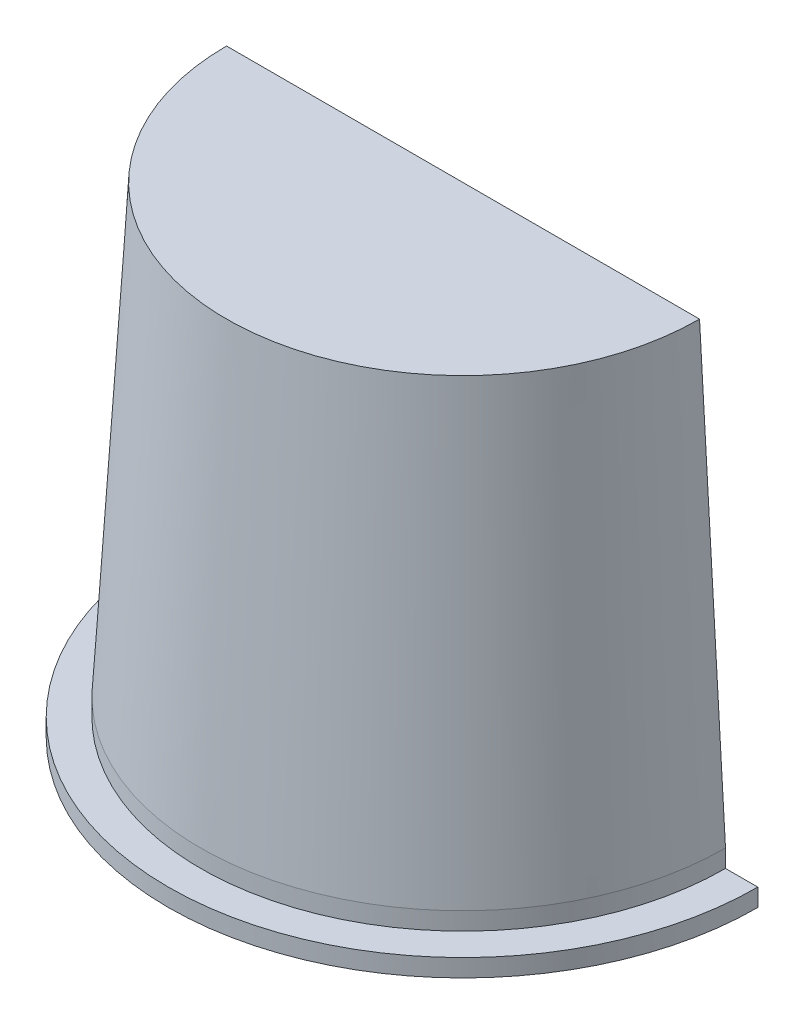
SolidWorks part; units mm, degrees
ref_plane "Спереди" through (0, 0, 0) normal (0, 0, 1) x (1, 0, 0)
ref_plane "Сверху" through (0, 0, 0) normal (0, 1, 0) x (1, 0, 0)
ref_plane "Справа" through (0, 0, 0) normal (1, 0, 0) x (0, 0, -1)
sketch "Эскиз1" plane through (0, 0, 0) normal (1, 0, 0) x (0, 0, -1)
  line L0 (0, 0) -> (-43.5, 0) construction
  line L1 (-44.5209, -17.5014) -> (0, -17.5014)
  line L5 (0, 58) -> (-40.1167, 58)
  line L6 (-40.1167, 58) -> (-43.5, 0)
  line L7 (0, 0) -> (0, 60) construction
  line L9 (0, -17.5014) -> (0, 58)
  line L10 (-43.5, 0) -> (-44.5209, -17.5014)
  dimension "D1" = 60
  dimension "D4" = 2
revolve "Повернуть1" add sketch "Эскиз1" angle 360 about L7
sketch "Sketch1" plane through (0, 0, 0) normal (0, 0, 1) x (1, 0, 0)
  line L1 (-56.6525, -26.6884) -> (65.1206, -26.6884)
  line L2 (-56.6525, -26.6884) -> (-56.6525, 69.3771)
  line L3 (-56.6525, 69.3771) -> (65.1206, 69.3771)
  line L4 (65.1206, -26.6884) -> (65.1206, 69.3771)
extrude "Cut-Extrude1" cut sketch "Sketch1" against normal through all
sketch "Sketch2" plane through (0, -17.5014, 0) normal (0, -1, 0) x (1, 0, 0)
  line L0 (-44.5209, 0) -> (44.5209, 0)
  arc A0 (44.5209, 0) -> (-44.5209, 0) centre (0, 0) ccw
extrude "Boss-Extrude1" add sketch "Sketch2" along normal blind 3 contours A0 L0
sketch "Sketch3" plane through (0, -20.5014, 0) normal (0, -1, 0) x (1, 0, 0)
  line L0 (-50, 0) -> (50, 0)
  arc A0 (50, 0) -> (-50, 0) centre (0, 0) ccw
extrude "Boss-Extrude2" add sketch "Sketch3" along normal blind 3
